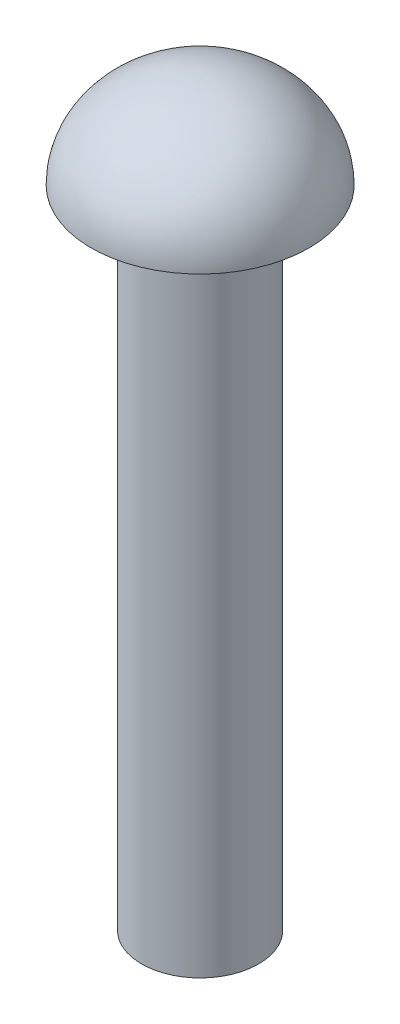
SolidWorks part; units mm, degrees
ref_plane "Plan de face" through (0, 0, 0) normal (0, 0, 1) x (1, 0, 0)
ref_plane "Plan de dessus" through (0, 0, 0) normal (0, 1, 0) x (1, 0, 0)
ref_plane "Plan de droite" through (0, 0, 0) normal (1, 0, 0) x (0, 0, -1)
sketch "Esquisse1" plane through (0, 0, 0) normal (0, 0, 1) x (1, 0, 0)
  line L0 (-15.0239, 0) -> (46.8695, 0) construction
  line L1 (0, -11.0432) -> (0, 21.8296) construction
  line L2 (2.7, 14.5543) -> (2.7, -9.2771) construction
  line L3 (12.9765, 2.3) -> (-6.2853, 2.3) construction
  line L4 (0, 0) -> (2.7, 0)
  line L5 (0, 2.3) -> (0, 0)
  ellipse E0 centre (0, 0) end of major axis (2.7, 0) minor radius 2.3 (2.7, 0) -> (0, 2.3) ccw
  dimension "D1" = 2.7
  dimension "D2" = 2.3
revolve "Révolution2" add sketch "Esquisse1" angle 360 about L1
sketch "Esquisse2" plane through (0, 0, 0) normal (0, -1, 0) x (1, 0, 0)
  circle A0 centre (0, 0) radius 1.45
extrude "Boss.-Extru.1" add sketch "Esquisse2" along normal blind 16
